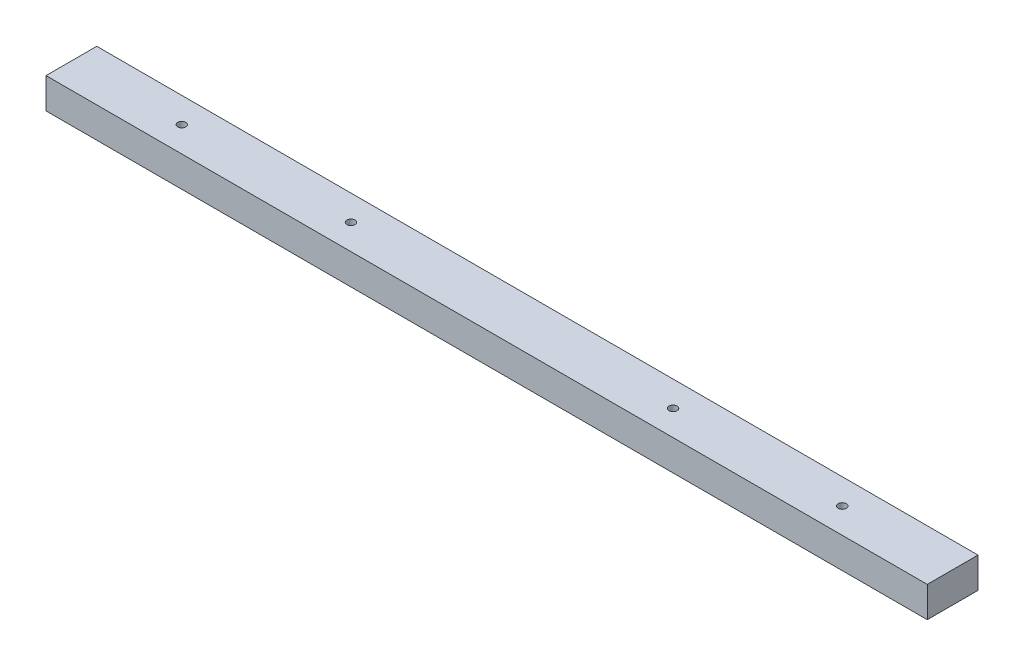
SolidWorks part; units mm, degrees
ref_plane "Front Plane" through (0, 0, 0) normal (0, 0, 1) x (1, 0, 0)
ref_plane "Top Plane" through (0, 0, 0) normal (0, 1, 0) x (1, 0, 0)
ref_plane "Right Plane" through (0, 0, 0) normal (1, 0, 0) x (0, 0, -1)
sketch "Sketch1" plane through (0, 0, 0) normal (0, 1, 0) x (1, 0, 0)
  line L1 (0, 0) -> (1220, 0)
  line L2 (0, 0) -> (0, 63)
  line L3 (0, 63) -> (1220, 63)
  line L4 (1220, 0) -> (1220, 63)
  dimension "D1" = 1220
  dimension "D2" = 63
extrude "Boss-Extrude1" add sketch "Sketch1" along normal blind 38
sketch "Sketch2" plane through (0, 38, 0) normal (0, 1, 0) x (1, 0, 0)
  line L0 (0, 31.5) -> (1220, 31.5) construction
  line L1 (0, 63) -> (0, 0) construction
  line L2 (1220, 0) -> (1220, 63) construction
  line L3 (200, 31.5) -> (410, 31.5) construction
  line L4 (610, 63) -> (610, 0) construction
  line L5 (1220, 63) -> (0, 63) construction
  line L6 (0, 0) -> (1220, 0) construction
  circle A0 centre (200, 31.5) radius 5
  circle A2 centre (410, 31.5) radius 5
  circle A3 centre (810, 31.5) radius 5
  circle A4 centre (1020, 31.5) radius 5
extrude "Cut-Extrude1" cut sketch "Sketch2" against normal blind 38
sketch "Sketch3" plane through (0, 38, 0) normal (0, 1, 0) x (1, 0, 0)
  line L0 (1220, 63) -> (0, 63) construction
  line L1 (0, 0) -> (63, 0)
  line L2 (0, 0) -> (0, 63)
  line L3 (0, 63) -> (63, 63)
  line L4 (63, 0) -> (63, 63)
  line L5 (610, 0) -> (610, 63) construction
  line L6 (0, 0) -> (1220, 0) construction
  line L7 (1220, 63) -> (1157, 63)
  line L8 (1157, 0) -> (1157, 63)
  line L9 (1220, 0) -> (1157, 0)
  line L10 (1220, 0) -> (1220, 63)
  dimension "D1" = 63
extrude "Cut-Extrude2" cut sketch "Sketch3" against normal up to next
equation "\"Hole Diameter\"= 10"
equation "\"D1@Sketch2\"=\"Hole Diameter\""
